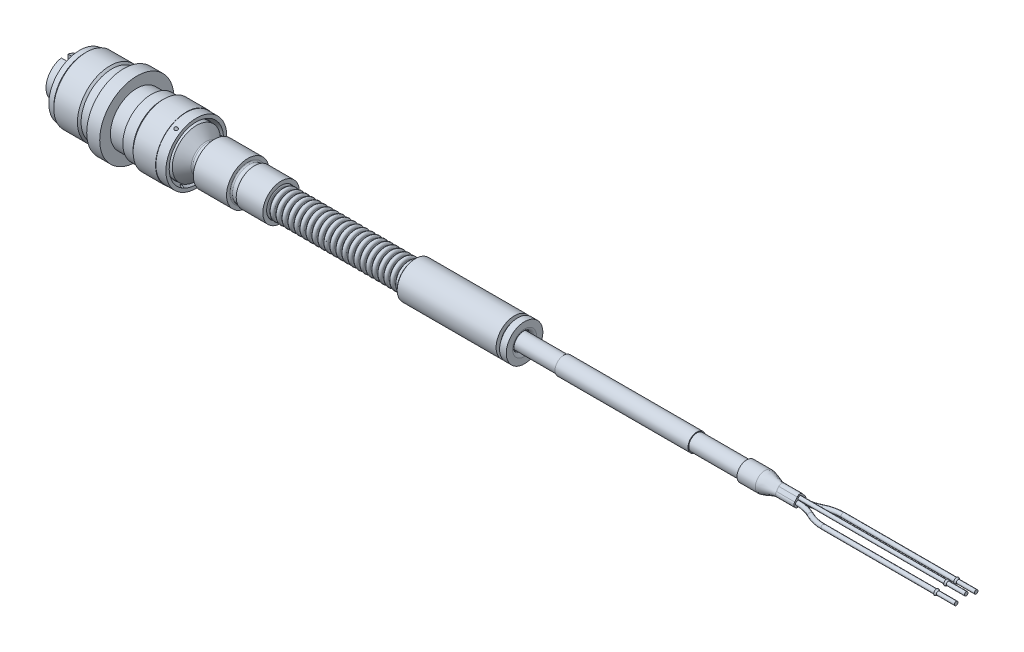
SolidWorks part; units mm, degrees
ref_plane "Plan de face" through (0, 0, 0) normal (0, 0, 1) x (1, 0, 0)
ref_plane "Plan de dessus" through (0, 0, 0) normal (0, 1, 0) x (1, 0, 0)
ref_plane "Plan de droite" through (0, 0, 0) normal (1, 0, 0) x (0, 0, -1)
imported_body "922-319-000-102-K219-957.35.20.3000^922-319-000-103-1-solid1"
imported_body "922-319-000-102-K219-957.35.20.3000^922-319-000-103-1-solid2"
imported_body "922-319-000-102-K219-957.35.20.3000^922-319-000-103-1-solid3"
imported_body "922-319-000-102-K219-957.35.20.3000^922-319-000-103-1-solid4"
imported_body "922-319-000-102-K219-957.35.20.3000^922-319-000-103-1-solid5"
imported_body "922-319-000-102-K219-957.35.20.3000^922-319-000-103-1-solid6"
imported_body "957.11.07.0312-2-solid1"
imported_body "957.11.07.0312-2-solid2"
imported_body "957.11.07.0312-2-solid3"
imported_body "957.11.07.0128-1-solid1"
imported_body "957.11.07.0128-1-solid2"
imported_body "922-319-001-102-1-solid1"
imported_body "922-319-000-102-958-11-21-0101^922-319-000-103-1-solid1"
imported_body "444-310-053-101-1-solid1"
imported_body "957.12.07.1002^922-319-000-103-1-solid1"
imported_body "957.12.07.1002^922-319-000-103-1-solid2"
imported_body "957.12.07.1002^922-319-000-103-1-solid3"
imported_body "957.12.07.1002^922-319-000-103-1-solid4"
imported_body "957.12.07.1002^922-319-000-103-1-solid5"
imported_body "957.12.07.1002^922-319-000-103-1-solid6"
imported_body "957.12.07.1002^922-319-000-103-1-solid7"
imported_body "957.12.07.7101-1-solid1"
imported_body "957.12.07.7101-2-solid1"
imported_body "957.12.07.7101-3-solid1"
imported_body "922-319-002-102-1-solid1"
imported_body "957.12.07.7119-1-solid1"
imported_body "957.12.07.7119-2-solid1"
imported_body "957.19.91.0605^922-319-000-103-1-solid1"
sketch "Esquisse1" plane through (0, 0, 0) normal (0, 0, 1) x (1, 0, 0)
  line L0 (-57.2138, 0) -> (86.7362, 0) construction
  line L1 (-29, 0) -> (-29, 8.3208)
  line L2 (-29, 8.05) -> (-29, -8.05) construction
  line L3 (-29, 8.6) -> (-29, -8.6) construction
  line L4 (-29, 8.3208) -> (-18.1124, 8.3208)
  line L5 (-18.1124, 8.3208) -> (-18.1124, 6.8907)
  line L6 (-18.1124, 6.8907) -> (-12.0708, 3.5838)
  line L7 (-12.0708, 3.5838) -> (-10, 3.5838)
  line L8 (-10, 4.325) -> (-10, -4.325) construction
  line L9 (-10, 3.5838) -> (-10, 5.3356)
  line L10 (-10, 6.4) -> (-10, -6.4) construction
  line L11 (-10, 5.3356) -> (-0.8428, 5.3356)
  line L12 (-0.8428, 5.3356) -> (0.2116, 4.6334)
  line L13 (0.2116, 4.6334) -> (4.0573, 4.6334)
  line L14 (4.0573, 4.6334) -> (4.0573, 0)
  line L15 (4.0573, 0) -> (-29, 0)
  line L16 (56.0369, 4.6158) -> (56.0369, 2.6)
  line L17 (56.0369, 2.6) -> (56.2, 2.6)
  line L18 (56.2, 2.6) -> (56.2, 4.6158)
  line L19 (56.2, 4.6158) -> (56.0369, 4.6158)
  point P25 (0, 0)
revolve "Révolution1" add sketch "Esquisse1" angle 360 about L0
sketch "Esquisse2" plane through (4.0573, 0, 0) normal (1, 0, 0) x (0, 0, -1)
  circle A0 centre (0, 0) radius 2.4 construction
  circle A1 centre (0, 0) radius 2.4
extrude "Boss.-Extru.1" add sketch "Esquisse2" along normal up to surface (145.9427 mm away)
sketch "Esquisse3" plane through (166, 0, 0) normal (1, 0, 0) x (0, 0, -1)
  line L3 (1.5614, 0.7013) -> (0.8322, 1.649)
  line L4 (-0.8322, 1.649) -> (-1.5614, 0.7013)
  line L5 (-0.65, -1.15) -> (0.65, -1.15)
  line L6 (1.5614, 0.7013) -> (0.8322, 1.649)
  line L7 (-0.8322, 1.649) -> (-1.5614, 0.7013)
  line L8 (-0.65, -1.15) -> (0.65, -1.15)
  arc A3 (0.65, -1.15) -> (1.5614, 0.7013) centre (0.65, 0) ccw
  arc A4 (0.8322, 1.649) -> (-0.8322, 1.649) centre (0, 1.0087) ccw
  arc A5 (-1.5614, 0.7013) -> (-0.65, -1.15) centre (-0.65, 0) ccw
  arc A6 (0.65, -1.15) -> (1.5614, 0.7013) centre (0.65, 0) ccw
  arc A7 (0.8322, 1.649) -> (-0.8322, 1.649) centre (0, 1.0087) ccw
  arc A8 (-1.5614, 0.7013) -> (-0.65, -1.15) centre (-0.65, 0) ccw
  dimension "D1" = 0
extrude "Boss.-Extru.2" add sketch "Esquisse3" against normal blind 7
sketch "Esquisse4" plane through (216, 0, 0) normal (1, 0, 0) x (0, 0, -1)
  circle A0 centre (3, 0) radius 0.4 construction
  circle A1 centre (0, 1.0087) radius 0.4 construction
  circle A2 centre (-3, 0) radius 0.4 construction
  circle A3 centre (3, 0) radius 0.4
  circle A4 centre (0, 1.0087) radius 0.4
  circle A5 centre (-3, 0) radius 0.4
extrude "Boss.-Extru.3" add sketch "Esquisse4" against normal blind 7
delete or keep bodies "Corps-Supprimer/Garder 1" type delete bodies bodies 104 105 126 127
